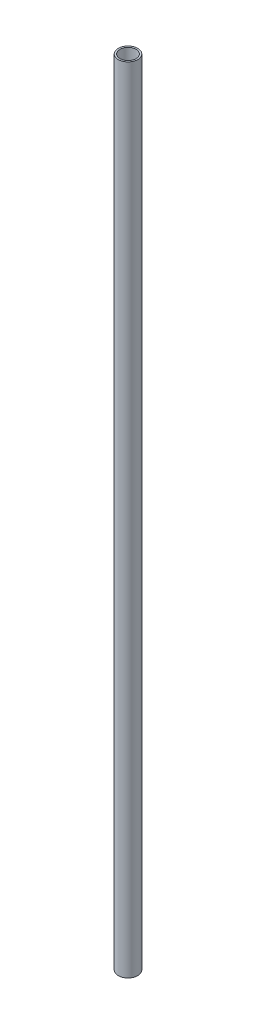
SolidWorks part; units mm, degrees
ref_plane "Front Plane" through (0, 0, 0) normal (0, 0, 1) x (1, 0, 0)
ref_plane "Top Plane" through (0, 0, 0) normal (0, 1, 0) x (1, 0, 0)
ref_plane "Right Plane" through (0, 0, 0) normal (1, 0, 0) x (0, 0, -1)
sketch "Sketch1" plane through (0, 0, 0) normal (0, 1, 0) x (1, 0, 0)
  circle A0 centre (0, 0) radius 9.525
  dimension "D1" = 19.05
extrude "Extrude-Thin1" add sketch "Sketch1" along normal blind 774.7 thin
